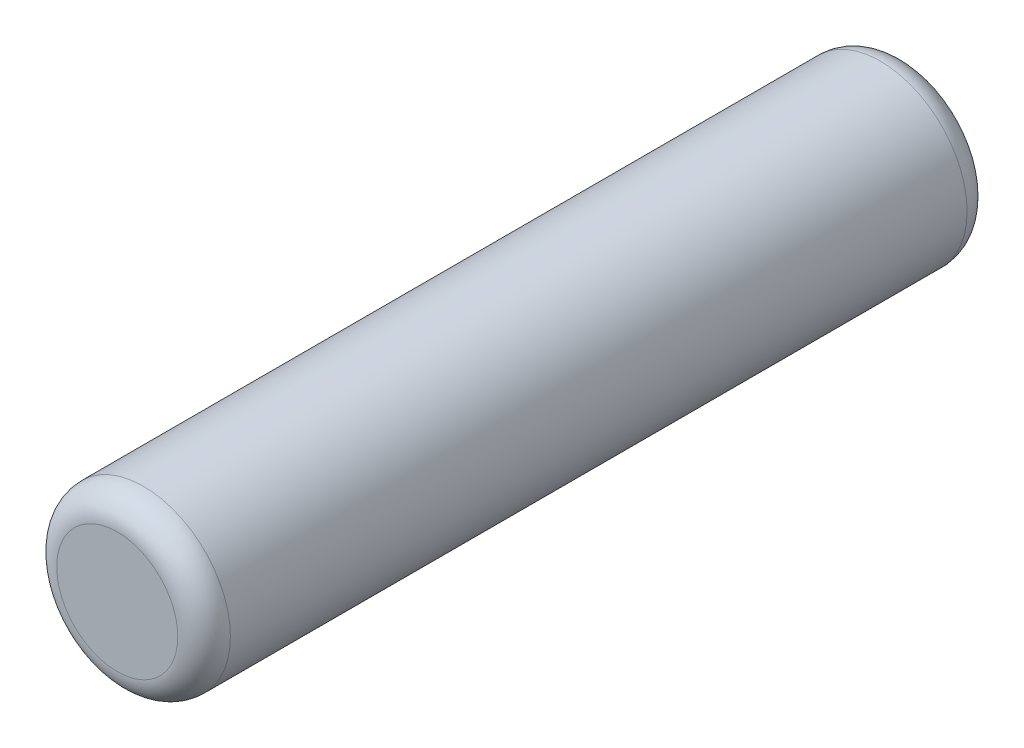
SolidWorks part; units mm, degrees
ref_plane "Plan de face" through (0, 0, 0) normal (0, 0, 1) x (1, 0, 0)
ref_plane "Plan de dessus" through (0, 0, 0) normal (0, 1, 0) x (1, 0, 0)
ref_plane "Plan de droite" through (0, 0, 0) normal (1, 0, 0) x (0, 0, -1)
sketch "Esquisse3" plane through (0, 0, 0) normal (0, 0, 1) x (1, 0, 0)
  circle A0 centre (0, 0) radius 3.3
  dimension "D1" = 6.6
extrude "Extrusion2" add sketch "Esquisse3" along normal blind 30
fillet "Congé2" radius 1 2 edges at (3.3, 0, 0) (3.3, 0, 30)
